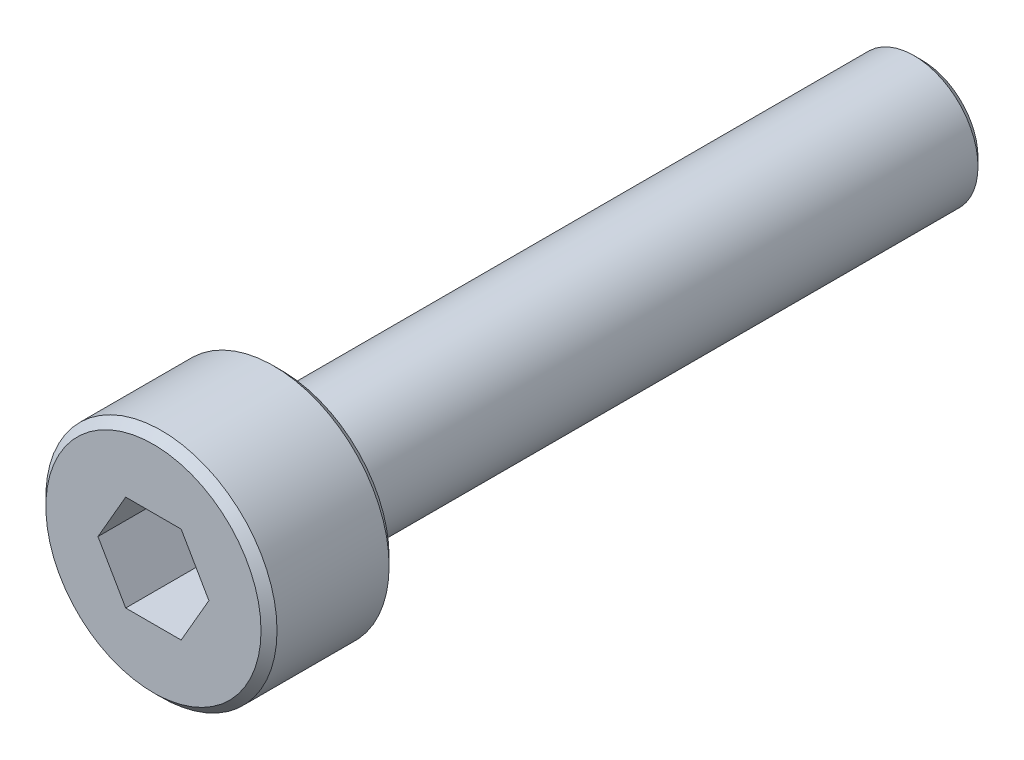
SolidWorks part; units mm, degrees
ref_plane "Front Plane" through (0, 0, 0) normal (1, 0, 0) x (0, 1, 0)
ref_plane "Top Plane" through (0, 0, 0) normal (0, 0, 1) x (0, 1, 0)
ref_plane "Right Plane" through (0, 0, 0) normal (0, 1, 0) x (-1, 0, 0)
sketch "Sketch1" plane through (0, 0, 0) normal (0, 0, 1) x (0, 1, 0)
  circle A0 centre (0, 0) radius 2
  dimension "D1" = 4
extrude "Boss-Extrude1" add sketch "Sketch1" along normal blind 20
sketch "Sketch2" plane through (0, 0, 20) normal (0, 0, 1) x (1, 0, 0)
  circle A0 centre (0, 0) radius 3.61
  dimension "D1" = 7.22
extrude "Boss-Extrude2" add sketch "Sketch2" along normal blind 4
sketch "Sketch3" plane through (0, 0, 24) normal (0, 0, 1) x (1, 0, 0)
  line L1 (1.7321, 0) -> (0.866, 1.5)
  line L2 (0.866, 1.5) -> (-0.866, 1.5)
  line L3 (-0.866, 1.5) -> (-1.7321, 0)
  line L4 (-1.7321, 0) -> (-0.866, -1.5)
  line L5 (-0.866, -1.5) -> (0.866, -1.5)
  line L6 (0.866, -1.5) -> (1.7321, 0)
  circle A0 centre (0, 0) radius 1.5 construction
  dimension "D1" = 3
extrude "Cut-Extrude1" cut sketch "Sketch3" against normal blind 2.5
chamfer "Chamfer1" distance 0.25 angle 45 3 edges at (2, 0, 0) (3.61, 0, 20) (3.61, 0, 24)
